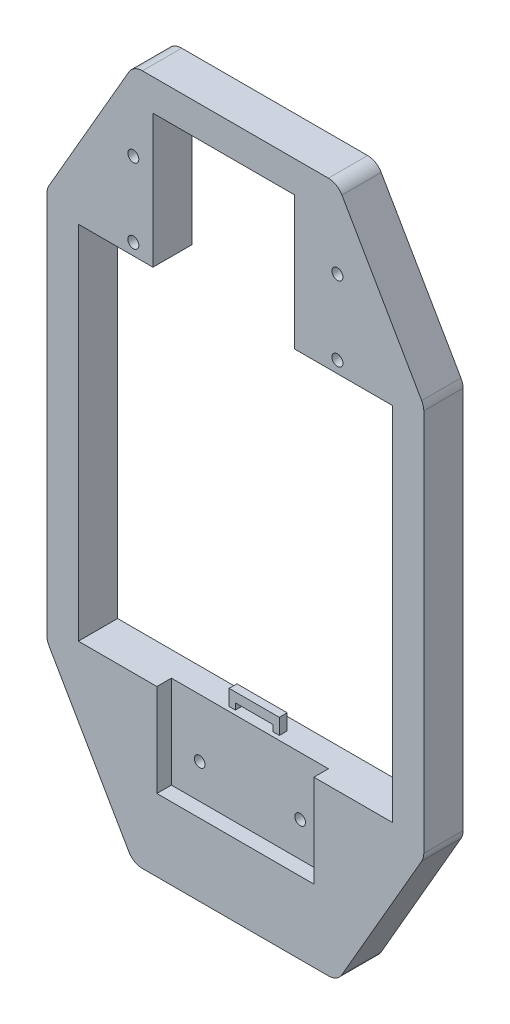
SolidWorks part; units mm, degrees
ref_plane "前视基准面" through (0, 0, 0) normal (0, 0, 1) x (1, 0, 0)
ref_plane "上视基准面" through (0, 0, 0) normal (0, 1, 0) x (1, 0, 0)
ref_plane "右视基准面" through (0, 0, 0) normal (1, 0, 0) x (0, 0, -1)
sketch "草图1" plane through (0, 0, 0) normal (0, 0, 1) x (1, 0, 0)
  line L0 (-98.6603, 121.6667) -> (-56.3212, 195)
  line L1 (47.661, 200) -> (-47.661, 200)
  line L2 (100, 116.6667) -> (100, -116.6667)
  line L3 (47.661, -200) -> (-47.661, -200)
  line L4 (-100, 116.6667) -> (-100, -116.6667)
  line L5 (-118.6603, 127.0257) -> (-67.8682, 215)
  line L6 (59.208, 220) -> (-59.208, 220)
  line L7 (0, 0) -> (0, 150) construction
  line L8 (0, 0) -> (100, 0) construction
  line L9 (98.6603, 121.6667) -> (56.3212, 195)
  line L10 (98.6603, -121.6667) -> (56.3212, -195)
  line L11 (-98.6603, -121.6667) -> (-56.3212, -195)
  line L12 (118.6603, 127.0257) -> (67.8682, 215)
  line L13 (120, 122.0257) -> (120, -122.0257)
  line L14 (118.6603, -127.0257) -> (67.8682, -215)
  line L15 (59.208, -220) -> (-59.208, -220)
  line L16 (-118.6603, -127.0257) -> (-67.8682, -215)
  line L17 (-120, 122.0257) -> (-120, -122.0257)
  line L18 (-120, -124.7051) -> (-64.9815, -220) construction
  line L19 (-120, 124.7051) -> (-120, -124.7051) construction
  line L20 (64.9815, -220) -> (-64.9815, -220) construction
  line L21 (120, -124.7051) -> (64.9815, -220) construction
  line L22 (120, 124.7051) -> (120, -124.7051) construction
  line L23 (-100, -119.3462) -> (-53.4345, -200) construction
  line L24 (53.4345, -200) -> (-53.4345, -200) construction
  line L25 (-100, 119.3462) -> (-100, -119.3462) construction
  line L26 (100, -119.3462) -> (53.4345, -200) construction
  line L27 (100, 119.3462) -> (100, -119.3462) construction
  line L28 (100, 119.3462) -> (53.4345, 200) construction
  line L29 (53.4345, 200) -> (-53.4345, 200) construction
  line L30 (-100, 119.3462) -> (-53.4345, 200) construction
  line L31 (120, 124.7051) -> (64.9815, 220) construction
  line L32 (64.9815, 220) -> (-64.9815, 220) construction
  line L33 (-120, 124.7051) -> (-64.9815, 220) construction
  arc A0 (-118.6603, -127.0257) -> (-120, -122.0257) centre (-110, -122.0257) cw
  arc A1 (-59.208, -220) -> (-67.8682, -215) centre (-59.208, -210) cw
  arc A2 (67.8682, -215) -> (59.208, -220) centre (59.208, -210) cw
  arc A3 (120, -122.0257) -> (118.6603, -127.0257) centre (110, -122.0257) cw
  arc A4 (-56.3212, -195) -> (-47.661, -200) centre (-47.661, -190) ccw
  arc A5 (-98.6603, -121.6667) -> (-100, -116.6667) centre (-90, -116.6667) cw
  arc A6 (56.3212, -195) -> (47.661, -200) centre (47.661, -190) cw
  arc A7 (98.6603, -121.6667) -> (100, -116.6667) centre (90, -116.6667) ccw
  arc A8 (56.3212, 195) -> (47.661, 200) centre (47.661, 190) ccw
  arc A9 (98.6603, 121.6667) -> (100, 116.6667) centre (90, 116.6667) cw
  arc A10 (-56.3212, 195) -> (-47.661, 200) centre (-47.661, 190) cw
  arc A11 (-98.6603, 121.6667) -> (-100, 116.6667) centre (-90, 116.6667) ccw
  arc A12 (118.6603, 127.0257) -> (120, 122.0257) centre (110, 122.0257) cw
  arc A13 (59.208, 220) -> (67.8682, 215) centre (59.208, 210) cw
  arc A14 (-67.8682, 215) -> (-59.208, 220) centre (-59.208, 210) cw
  arc A15 (-118.6603, 127.0257) -> (-120, 122.0257) centre (-110, 122.0257) ccw
  point P0 (0, 0)
  point P37 (-53.4345, -200)
  point P50 (53.4345, 200)
  dimension "D6" = 10
  dimension "D7" = 73.3333
  dimension "D1" = 400
  dimension "D2" = 200
  dimension "D3" = 100
  dimension "D4" = 200
  dimension "D5" = 20
  dimension "D8" = 30
  dimension "D9" = 73.3333
  dimension "D10" = 30
extrude "凸台-拉伸1" add sketch "草图1" along normal blind 30
sketch "草图2" plane through (0, 0, 30) normal (0, 0, 1) x (1, 0, 0)
  line L0 (-100, 130) -> (-70, 130)
  line L1 (-100, 116.6667) -> (-100, -116.6667) construction
  line L2 (-70, 130) -> (-70, 200)
  line L3 (47.661, 200) -> (-47.661, 200) construction
  line L4 (-70, 200) -> (-37.5, 200)
  line L5 (-37.5, 200) -> (-37.5, 115)
  line L6 (-37.5, 115) -> (-100, 115)
  line L7 (-100, 115) -> (-100, 130)
  line L8 (0, 0) -> (0, 200) construction
  dimension "D1" = 15
  dimension "D2" = 32.5
  dimension "D3" = 37.5
  dimension "D4" = 115
extrude "凸台-拉伸2" add sketch "草图2" against normal blind 40
mirror "镜向1" about plane through (0, 0, 0) normal (0, 1, 0) of "凸台-拉伸2"
mirror "镜向2" about plane through (0, 0, 0) normal (1, 0, 0) of "凸台-拉伸2", "镜向1"
sketch "草图3" plane through (0, 0, 0) normal (0, 0, -1) x (-1, 0, 0)
  line L0 (-100, 115) -> (100, 115)
  line L1 (100, 115) -> (100, -115)
  line L2 (100, -115) -> (-100, -115)
  line L3 (-100, -115) -> (-100, 115)
  line L8 (120, -122.0257) -> (120, 122.0257)
  line L10 (120, -122.0257) -> (120, 122.0257)
  line L12 (-120, 122.0257) -> (-120, -122.0257)
  line L13 (-118.6603, -127.0257) -> (-67.8682, -215)
  line L14 (118.6603, 127.0257) -> (67.8682, 215)
  line L20 (-120, 122.0257) -> (-120, -122.0257)
  line L21 (-118.6603, -127.0257) -> (-67.8682, -215)
  line L28 (118.6603, 127.0257) -> (67.8682, 215)
  line L29 (59.208, 220) -> (-59.208, 220)
  line L30 (59.208, 220) -> (-59.208, 220)
  line L31 (-67.8682, 215) -> (-118.6603, 127.0257)
  line L32 (-67.8682, 215) -> (-118.6603, 127.0257)
  line L34 (-59.208, -220) -> (59.208, -220)
  line L36 (-59.208, -220) -> (59.208, -220)
  line L38 (67.8682, -215) -> (118.6603, -127.0257)
  line L40 (67.8682, -215) -> (118.6603, -127.0257)
  arc A8 (118.6603, -127.0257) -> (120, -122.0257) centre (110, -122.0257) ccw
  arc A9 (118.6603, -127.0257) -> (120, -122.0257) centre (110, -122.0257) ccw
  arc A10 (120, 122.0257) -> (118.6603, 127.0257) centre (110, 122.0257) ccw
  arc A11 (120, 122.0257) -> (118.6603, 127.0257) centre (110, 122.0257) ccw
  arc A12 (-118.6603, 127.0257) -> (-120, 122.0257) centre (-110, 122.0257) ccw
  arc A13 (-120, -122.0257) -> (-118.6603, -127.0257) centre (-110, -122.0257) ccw
  arc A14 (67.8682, 215) -> (59.208, 220) centre (59.208, 210) ccw
  arc A15 (67.8682, 215) -> (59.208, 220) centre (59.208, 210) ccw
  arc A20 (-118.6603, 127.0257) -> (-120, 122.0257) centre (-110, 122.0257) ccw
  arc A21 (-120, -122.0257) -> (-118.6603, -127.0257) centre (-110, -122.0257) ccw
  arc A24 (-59.208, 220) -> (-67.8682, 215) centre (-59.208, 210) ccw
  arc A25 (-59.208, 220) -> (-67.8682, 215) centre (-59.208, 210) ccw
  arc A26 (-67.8682, -215) -> (-59.208, -220) centre (-59.208, -210) ccw
  arc A27 (-67.8682, -215) -> (-59.208, -220) centre (-59.208, -210) ccw
  arc A28 (59.208, -220) -> (67.8682, -215) centre (59.208, -210) ccw
  arc A29 (59.208, -220) -> (67.8682, -215) centre (59.208, -210) ccw
  dimension "D1" = 0
extrude "凸台-拉伸3" add sketch "草图3" along normal blind 20
sketch "草图5" plane through (0, 0, -20) normal (0, 0, -1) x (-1, 0, 0)
  line L0 (-67.8682, 215) -> (-67.8682, 310)
  line L1 (-67.8682, 310) -> (67.8682, 310)
  line L2 (67.8682, 310) -> (67.8682, 215)
  line L3 (59.208, 220) -> (-59.208, 220) construction
  line L4 (59.208, 220) -> (-59.208, 220)
  arc A0 (67.8682, 215) -> (59.208, 220) centre (59.208, 210) ccw construction
  arc A1 (-59.208, 220) -> (-67.8682, 215) centre (-59.208, 210) ccw construction
  arc A2 (67.8682, 215) -> (59.208, 220) centre (59.208, 210) ccw
  arc A3 (-59.208, 220) -> (-67.8682, 215) centre (-59.208, 210) ccw
  dimension "D1" = 90
extrude "凸台-拉伸11" add sketch "草图5" against normal blind 15 from offset 10
fillet "圆角3" radius 5 2 edges at (67.8682, 310, -2.5) (-67.8682, 310, -2.5)
sketch "草图6" plane through (0, 0, 0) normal (1, 0, 0) x (0, 0, -1)
  line L0 (-30, 220) -> (-5, 220) construction
  line L1 (17, 221) -> (-5, 221)
  line L2 (17, 221) -> (17, 199)
  line L3 (17, 199) -> (-5, 199)
  line L4 (-5, 221) -> (-5, 199)
  line L5 (17, 221) -> (-5, 199) construction
  line L6 (17, 199) -> (-5, 221) construction
  line L7 (-30, 127.0257) -> (-30, 215) construction
  point P0 (6, 210)
  dimension "D1" = 22
  dimension "D2" = 10
  dimension "D3" = 22
  dimension "D4" = 25
extrude "凸台-拉伸12" add sketch "草图6" along normal mid plane 450
sketch "草图10" plane through (0, 0, 30) normal (0, 0, 1) x (1, 0, 0)
  line L0 (-65, 122.5) -> (-65, 170) construction
  line L2 (-100, 115) -> (-37.5, 115) construction
  dimension "D1" = 65
  dimension "D2" = 7.5
  dimension "D3" = 47.5
hole_wizard "M8x1.0 螺纹孔1" positions "3D草图1" profile "草图11" tap size "M8x1.0" standard "GB"
sketch3d "3D草图1"
  point P0 (-65, 122.5, 30)
  point P3 (-65, 170, 30)
sketch "草图11" plane through (-65, 122.5, 30) normal (1, 0, 0) x (0, -1, 0)
  line L0 (0, 0) -> (0, 23.103)
  line L1 (0, 23.103) -> (3.5, 21)
  line L2 (3.5, 21) -> (3.5, 0)
  line L5 (3.5, 0) -> (0, 0)
  line L10 (0, 23.103) -> (-3.5, 21) construction
  line L11 (0, -6.35) -> (0, 107.95) construction
  dimension "螺纹孔钻头直径" = 7
  dimension "螺纹孔钻头深度" = 21
  dimension "导头角度" = 118
mirror "镜向7" about plane through (0, 0, 0) normal (1, 0, 0) of "M8x1.0 螺纹孔1"
sketch "草图14" plane through (0, 0, 0) normal (0, 0, 1) x (1, 0, 0)
  line L0 (-37.5, 200) -> (37.5, 200)
  line L1 (37.5, 200) -> (37.5, 199)
  line L2 (37.5, 199) -> (-37.5, 199)
  line L3 (-37.5, 199) -> (-37.5, 200)
extrude "切除-拉伸1" cut sketch "草图14" along normal blind 10
mirror "镜向8" about plane through (0, 0, 0) normal (0, 1, 0) of "切除-拉伸1", "凸台-拉伸12", "凸台-拉伸11"
sketch "草图15" plane through (0, 0, 5) normal (0, 0, 1) x (1, 0, 0)
  line L0 (225, 210) -> (191, 210) construction
  line L1 (194, 213) -> (188, 213)
  line L2 (194, 213) -> (194, 207)
  line L3 (194, 207) -> (188, 207)
  line L4 (188, 213) -> (188, 207)
  line L5 (194, 213) -> (188, 207) construction
  line L6 (194, 207) -> (188, 213) construction
  line L7 (225, 221) -> (225, 199) construction
  line L8 (191, 210) -> (176, 210) construction
  line L10 (179, 213) -> (173, 213)
  line L11 (179, 213) -> (179, 207)
  line L12 (179, 207) -> (173, 207)
  line L13 (173, 213) -> (173, 207)
  line L14 (179, 213) -> (173, 207) construction
  line L15 (179, 207) -> (173, 213) construction
  point P0 (191, 210)
  dimension "D1" = 6
  dimension "D2" = 6
  dimension "D3" = 34
  dimension "D4" = 15
  dimension "D5" = 6
  dimension "D6" = 6
extrude "切除-拉伸2" cut sketch "草图15" against normal blind 10
pattern_linear "阵列(线性)1" count 2 spacing 30 along (-1, 0, 0) of "切除-拉伸2"
sketch "草图16" plane through (0, 0, 5) normal (0, 0, 1) x (1, 0, 0)
  line L0 (135, 199) -> (135, -199)
  line L1 (225, 199) -> (77.1058, 199) construction
  line L2 (225, -199) -> (77.1058, -199) construction
  line L3 (135, -199) -> (77.1058, -199)
  line L4 (77.1058, -199) -> (118.6603, -127.0257)
  line L5 (120, -122.0257) -> (120, 122.0257) construction
  line L6 (120, -122.0257) -> (120, 122.0257)
  line L7 (118.6603, 127.0257) -> (67.8682, 215) construction
  line L8 (118.6603, 127.0257) -> (77.1058, 199)
  line L9 (135, 199) -> (77.1058, 199)
  line L10 (0, 0) -> (0, -200) construction
  line L11 (-37.5, -200) -> (37.5, -200) construction
  line L12 (-135, 199) -> (-77.1058, 199)
  line L13 (-118.6603, 127.0257) -> (-77.1058, 199)
  line L14 (-120, -122.0257) -> (-120, 122.0257)
  line L15 (-77.1058, -199) -> (-118.6603, -127.0257)
  line L16 (-135, -199) -> (-77.1058, -199)
  line L17 (-135, 199) -> (-135, -199)
  arc A0 (118.6603, -127.0257) -> (120, -122.0257) centre (110, -122.0257) ccw construction
  arc A1 (118.6603, -127.0257) -> (120, -122.0257) centre (110, -122.0257) ccw
  arc A2 (120, 122.0257) -> (118.6603, 127.0257) centre (110, 122.0257) ccw construction
  arc A3 (120, 122.0257) -> (118.6603, 127.0257) centre (110, 122.0257) ccw
  arc A4 (-120, 122.0257) -> (-118.6603, 127.0257) centre (-110, 122.0257) cw
  arc A5 (-118.6603, -127.0257) -> (-120, -122.0257) centre (-110, -122.0257) cw
  dimension "D1" = 15
extrude "凸台-拉伸13" add sketch "草图16" against normal blind 20 from offset 1
sketch "草图17" plane through (0, 0, 4) normal (0, 0, 1) x (1, 0, 0)
  line L0 (105.9734, 199) -> (135, 148.7244)
  line L1 (135, 199) -> (77.1058, 199) construction
  line L2 (135, -199) -> (135, 199) construction
  line L3 (135, 148.7244) -> (135, 199)
  line L4 (225, 199) -> (77.1058, 199) construction
  line L5 (135, 199) -> (105.9734, 199)
  line L6 (77.1058, 199) -> (118.6603, 127.0257) construction
  line L7 (118.6603, 127.0257) -> (67.8682, 215) construction
  line L8 (0, 0) -> (308.3014, 0) construction
  line L9 (135, -199) -> (105.9734, -199)
  line L10 (135, -148.7244) -> (135, -199)
  line L11 (105.9734, -199) -> (135, -148.7244)
  line L12 (0, 0) -> (0, -200) construction
  line L13 (-37.5, -200) -> (37.5, -200) construction
  line L14 (-105.9734, -199) -> (-135, -148.7244)
  line L15 (-135, -148.7244) -> (-135, -199)
  line L16 (-135, -199) -> (-105.9734, -199)
  line L17 (-135, 199) -> (-105.9734, 199)
  line L18 (-135, 148.7244) -> (-135, 199)
  line L19 (-105.9734, 199) -> (-135, 148.7244)
  dimension "D1" = 25
extrude "切除-拉伸3" cut sketch "草图17" against normal blind 20
fillet "圆角4" radius 5 8 edges at (105.9734, -199, -6) (135, -148.7244, -6) (135, 148.7244, -6) (105.9734, 199, -6) (-105.9734, 199, -6) (-135, 148.7244, -6) (-135, -148.7244, -6) (-105.9734, -199, -6)
sketch "草图18" plane through (225, 0, 0) normal (1, 0, 0) x (0, 0, -1)
  line L0 (-5, 199) -> (17, 199) construction
  line L1 (8, 203) -> (4, 203)
  line L2 (8, 203) -> (8, 195)
  line L3 (8, 195) -> (4, 195)
  line L4 (4, 203) -> (4, 195)
  line L5 (8, 203) -> (4, 195) construction
  line L6 (8, 195) -> (4, 203) construction
  point P0 (6, 199)
  dimension "D1" = 8
  dimension "D2" = 4
extrude "切除-拉伸4" cut sketch "草图18" against normal blind 100
mirror "镜向9" about plane through (0, 0, 0) normal (0, 1, 0) of "切除-拉伸4", "阵列(线性)1", "切除-拉伸2"
mirror "镜向11" about plane through (0, 0, 0) normal (1, 0, 0) of "镜向9", "切除-拉伸2", "阵列(线性)1", "切除-拉伸4"
sketch "草图19" plane through (0, 0, 30) normal (0, 0, 1) x (1, 0, 0)
  line L3 (-93.849, 130) -> (-70, 130)
  line L4 (-70, 130) -> (-70, 171.3077)
  line L5 (-70, 171.3077) -> (-93.849, 130)
  line L6 (-93.849, 130) -> (-70, 130)
  line L7 (-70, 130) -> (-70, 171.3077)
  line L8 (-70, 171.3077) -> (-93.849, 130)
  line L9 (93.849, 130) -> (70, 171.3077)
  line L10 (70, 171.3077) -> (70, 130)
  line L11 (70, 130) -> (93.849, 130)
  line L12 (93.849, 130) -> (70, 171.3077)
  line L13 (70, 171.3077) -> (70, 130)
  line L14 (70, 130) -> (93.849, 130)
  line L15 (93.849, -130) -> (70, -130)
  line L16 (70, -130) -> (70, -171.3077)
  line L17 (70, -171.3077) -> (93.849, -130)
  line L18 (93.849, -130) -> (70, -130)
  line L19 (70, -130) -> (70, -171.3077)
  line L20 (70, -171.3077) -> (93.849, -130)
  line L21 (-93.849, -130) -> (-70, -171.3077)
  line L22 (-70, -171.3077) -> (-70, -130)
  line L23 (-70, -130) -> (-93.849, -130)
  line L24 (-93.849, -130) -> (-70, -171.3077)
  line L25 (-70, -171.3077) -> (-70, -130)
  line L26 (-70, -130) -> (-93.849, -130)
  dimension "D1" = 0
  dimension "D2" = 0
  dimension "D3" = 0
  dimension "D4" = 0
extrude "凸台-拉伸14" add sketch "草图19" against normal up to next
sketch "草图20" plane through (0, 0, -20) normal (0, 0, -1) x (-1, 0, 0)
  line L1 (-100, 115) -> (100, 115)
  line L2 (-100, 115) -> (-100, -115)
  line L3 (-100, -115) -> (100, -115)
  line L4 (100, 115) -> (100, -115)
  line L8 (120, -122.0257) -> (120, 122.0257)
  line L9 (118.6603, 127.0257) -> (67.8682, 215)
  line L10 (59.208, 220) -> (-59.208, 220)
  line L11 (-67.8682, 215) -> (-118.6603, 127.0257)
  line L12 (-120, 122.0257) -> (-120, -122.0257)
  line L13 (-118.6603, -127.0257) -> (-67.8682, -215)
  line L14 (-59.208, -220) -> (59.208, -220)
  line L15 (67.8682, -215) -> (118.6603, -127.0257)
  line L16 (120, -122.0257) -> (120, 122.0257)
  line L17 (118.6603, 127.0257) -> (67.8682, 215)
  line L18 (59.208, 220) -> (-59.208, 220)
  line L19 (-67.8682, 215) -> (-118.6603, 127.0257)
  line L20 (-120, 122.0257) -> (-120, -122.0257)
  line L21 (-118.6603, -127.0257) -> (-67.8682, -215)
  line L22 (-59.208, -220) -> (59.208, -220)
  line L23 (67.8682, -215) -> (118.6603, -127.0257)
  arc A8 (118.6603, -127.0257) -> (120, -122.0257) centre (110, -122.0257) ccw
  arc A9 (120, 122.0257) -> (118.6603, 127.0257) centre (110, 122.0257) ccw
  arc A10 (67.8682, 215) -> (59.208, 220) centre (59.208, 210) ccw
  arc A11 (-59.208, 220) -> (-67.8682, 215) centre (-59.208, 210) ccw
  arc A12 (-118.6603, 127.0257) -> (-120, 122.0257) centre (-110, 122.0257) ccw
  arc A13 (-120, -122.0257) -> (-118.6603, -127.0257) centre (-110, -122.0257) ccw
  arc A14 (-67.8682, -215) -> (-59.208, -220) centre (-59.208, -210) ccw
  arc A15 (59.208, -220) -> (67.8682, -215) centre (59.208, -210) ccw
  arc A16 (118.6603, -127.0257) -> (120, -122.0257) centre (110, -122.0257) ccw
  arc A17 (120, 122.0257) -> (118.6603, 127.0257) centre (110, 122.0257) ccw
  arc A18 (67.8682, 215) -> (59.208, 220) centre (59.208, 210) ccw
  arc A19 (-59.208, 220) -> (-67.8682, 215) centre (-59.208, 210) ccw
  arc A20 (-118.6603, 127.0257) -> (-120, 122.0257) centre (-110, 122.0257) ccw
  arc A21 (-120, -122.0257) -> (-118.6603, -127.0257) centre (-110, -122.0257) ccw
  arc A22 (-67.8682, -215) -> (-59.208, -220) centre (-59.208, -210) ccw
  arc A23 (59.208, -220) -> (67.8682, -215) centre (59.208, -210) ccw
  dimension "D1" = 0
extrude "凸台-拉伸15" add sketch "草图20" along normal blind 12
sketch "草图22" plane through (67.8682, 0, 0) normal (1, 0, 0) x (0, 0, -1)
  line L0 (10, 305) -> (10, 221) construction
  line L1 (10, 262) -> (0, 262)
  line L2 (10, 262) -> (10, 290)
  line L3 (10, 290) -> (0, 290)
  line L4 (0, 262) -> (0, 290)
  line L5 (-5, 310) -> (10, 310) construction
  line L6 (0, 264) -> (10, 266)
  line L7 (10, 272) -> (0, 274)
  line L8 (0, 276) -> (10, 276) construction
  line L9 (10, 280) -> (0, 278)
  line L10 (0, 288) -> (10, 286)
  dimension "D1" = 10
  dimension "D2" = 28
  dimension "D3" = 20
  dimension "D4" = 4
  dimension "D5" = 4
  dimension "D6" = 2
  dimension "D7" = 10
extrude "切除-拉伸5" cut sketch "草图22" against normal blind 20 contours L2 L7 L4 L6 | L10 L4 L9 L2
mirror "镜向12" about plane through (0, 0, 0) normal (1, 0, 0) of "切除-拉伸5"
sketch "草图24" plane through (0, 0, 0) normal (0, 0, 1) x (1, 0, 0)
  line L4 (-37.5, -115) -> (-37.5, -200)
  line L5 (-37.5, -200) -> (37.5, -200)
  line L6 (37.5, -200) -> (37.5, -115)
  line L7 (37.5, -115) -> (-37.5, -115)
  line L8 (-37.5, -115) -> (-37.5, -200)
  line L9 (-37.5, -200) -> (37.5, -200)
  line L10 (37.5, -200) -> (37.5, -115)
  line L11 (37.5, -115) -> (-37.5, -115)
  dimension "D1" = 0
extrude "凸台-拉伸16" add sketch "草图24" along normal up to surface (30 mm away)
sketch "草图25" plane through (0, -115, 0) normal (0, 1, 0) x (1, 0, 0)
  line L0 (0, -30) -> (0, 22) construction
  line L1 (-100, -30) -> (100, -30) construction
  dimension "D1" = 52
hole_wizard "M8 螺纹孔1" positions "3D草图2" profile "草图26" tap size "M8" standard "GB"
sketch3d "3D草图2"
  point P0 (0, -115, -22)
sketch "草图26" plane through (0, -115, -22) normal (1, 0, 0) x (0, 0, 1)
  line L0 (0, 0) -> (0, 22.0429)
  line L1 (0, 22.0429) -> (3.4, 20)
  line L2 (3.4, 20) -> (3.4, 0)
  line L5 (3.4, 0) -> (0, 0)
  line L10 (0, 22.0429) -> (-3.4, 20) construction
  line L11 (0, -6.35) -> (0, 107.95) construction
  dimension "螺纹孔钻头直径" = 6.8
  dimension "螺纹孔钻头深度" = 20
  dimension "导头角度" = 118
sketch "草图27" plane through (0, 0, 30) normal (0, 0, 1) x (1, 0, 0)
  line L0 (-16, -115) -> (-16, -105)
  line L1 (-100, -115) -> (100, -115) construction
  line L2 (-16, -105) -> (16, -105)
  line L3 (0, -105) -> (0, -111) construction
  line L4 (12, -111) -> (-12, -111)
  line L5 (-12, -111) -> (-12, -115)
  line L6 (-12, -115) -> (-16, -115)
  line L7 (0, 0) -> (0, -105) construction
  line L8 (12, -115) -> (16, -115)
  line L9 (12, -111) -> (12, -115)
  line L10 (16, -115) -> (16, -105)
  dimension "D1" = 6
  dimension "D2" = 10
  dimension "D3" = 12
  dimension "D4" = 16
extrude "凸台-拉伸17" add sketch "草图27" against normal blind 5 from offset 12
pattern_linear "阵列(线性)2" count 2 spacing 26 along (0, 0, -1) of "凸台-拉伸17"
sketch "草图28" plane through (0, 0, 30) normal (0, 0, 1) x (1, 0, 0)
  line L0 (0, -115) -> (0, -152) construction
  line L1 (-100, -115) -> (100, -115) construction
  line L2 (0, -152) -> (-32, -152) construction
  line L3 (0, -152) -> (32, -152) construction
  dimension "D1" = 37
  dimension "D2" = 32
  dimension "D3" = 32
hole_wizard "M8 螺纹孔2" positions "3D草图3" profile "草图29" tap size "M8" standard "GB"
sketch3d "3D草图3"
  point P0 (-32, -152, 30)
  point P3 (32, -152, 30)
sketch "草图29" plane through (-32, -152, 30) normal (1, 0, 0) x (0, -1, 0)
  line L0 (0, 0) -> (0, 24.5429)
  line L1 (0, 24.5429) -> (3.4, 22.5)
  line L2 (3.4, 22.5) -> (3.4, 0)
  line L5 (3.4, 0) -> (0, 0)
  line L10 (0, 24.5429) -> (-3.4, 22.5) construction
  line L11 (0, -6.35) -> (0, 107.95) construction
  dimension "螺纹孔钻头直径" = 6.8
  dimension "螺纹孔钻头深度" = 22.5
  dimension "导头角度" = 118
sketch "草图30" plane through (-67.8682, 0, 0) normal (-1, 0, 0) x (0, 0, 1)
  line L0 (-10, -310) -> (-38.263, -300.579)
  line L1 (-57.2367, -297.5) -> (-125, -297.5)
  line L2 (-127.5, -295) -> (-127.5, -290)
  line L3 (-125, -287.5) -> (-10, -287.5)
  line L4 (-10, -221) -> (-10, -310) construction
  line L5 (-10, -287.5) -> (-10, -310)
  arc A0 (-38.263, -300.579) -> (-57.2367, -297.5) centre (-57.2367, -357.5) ccw
  arc A1 (-127.5, -290) -> (-125, -287.5) centre (-125, -290) cw
  arc A2 (-125, -297.5) -> (-127.5, -295) centre (-125, -295) cw
  point P10 (-47.5, -297.5)
  point P13 (-127.5, -287.5)
  point P16 (-127.5, -297.5)
  dimension "D5" = 60
  dimension "D6" = 2.5
  dimension "D1" = 12.5
  dimension "D2" = 10
  dimension "D3" = 117.5
  dimension "D4" = 80
extrude "凸台-拉伸18" add sketch "草图30" against normal up to surface (135.7365 mm away)
fillet "圆角5" radius 10 2 edges at (0, -287.5, -10) (0, -310, -10)
sketch "草图31" plane through (0, -297.5, 0) normal (0, -1, 0) x (1, 0, 0)
  line L0 (0, -127.5) -> (0, -111.75) construction
  line L1 (67.8682, -127.5) -> (-67.8682, -127.5) construction
  line L2 (0, -111.75) -> (-45, -111.75) construction
  line L3 (0, -111.75) -> (45, -111.75) construction
  circle A0 centre (-45, -111.75) radius 5
  circle A1 centre (45, -111.75) radius 5
  dimension "D4" = 10
  dimension "D5" = 10
  dimension "D1" = 15.75
  dimension "D2" = 45
  dimension "D3" = 45
extrude "切除-拉伸6" cut sketch "草图31" against normal blind 10
sketch "草图32" plane through (0, 0, 30) normal (0, 0, 1) x (1, 0, 0)
  line L0 (-37.5, 200) -> (-52.5, 200)
  line L1 (-52.5, 200) -> (-52.5, 115)
  line L2 (-100, 115) -> (-37.5, 115) construction
  line L3 (-52.5, 115) -> (-37.5, 115)
  line L4 (-37.5, 115) -> (-37.5, 200)
  dimension "D1" = 15
extrude "切除-拉伸7" cut sketch "草图32" against normal up to surface (30 mm away)
sketch "草图33" plane through (0, 0, 0) normal (0, 0, 1) x (1, 0, 0)
  line L4 (37.5, 115) -> (37.5, 200)
  line L5 (37.5, 200) -> (-52.5, 200)
  line L6 (-52.5, 200) -> (-52.5, 115)
  line L7 (-52.5, 115) -> (37.5, 115)
  line L8 (37.5, 115) -> (37.5, 200)
  line L9 (37.5, 200) -> (-52.5, 200)
  line L10 (-52.5, 200) -> (-52.5, 115)
  line L11 (-52.5, 115) -> (37.5, 115)
  dimension "D1" = 0
extrude "切除-拉伸8" cut sketch "草图33" against normal blind 12
sketch "草图34" plane through (0, 0, 30) normal (0, 0, 1) x (1, 0, 0)
  line L0 (-100, -115) -> (100, -115) construction
  line L1 (-50, -115) -> (50, -115)
  line L2 (-50, -115) -> (-50, -174)
  line L3 (-50, -174) -> (50, -174)
  line L4 (50, -115) -> (50, -174)
  line L5 (0, -174) -> (0, -220) construction
  line L6 (59.208, -220) -> (-59.208, -220) construction
  dimension "D1" = 100
  dimension "D2" = 59
extrude "切除-拉伸9" cut sketch "草图34" against normal blind 9.25
sketch "草图35" plane through (0, 0, -127.5) normal (0, 0, -1) x (-1, 0, 0)
  line L1 (-263.8139, 338.959) -> (263.8139, 338.959)
  line L2 (-263.8139, 338.959) -> (-263.8139, -338.959)
  line L3 (-263.8139, -338.959) -> (263.8139, -338.959)
  line L4 (263.8139, 338.959) -> (263.8139, -338.959)
  line L5 (-263.8139, 338.959) -> (263.8139, -338.959) construction
  line L6 (-263.8139, -338.959) -> (263.8139, 338.959) construction
  point P0 (0, 0)
extrude "切除-拉伸11" cut sketch "草图35" against normal up to surface (132.5 mm away)
